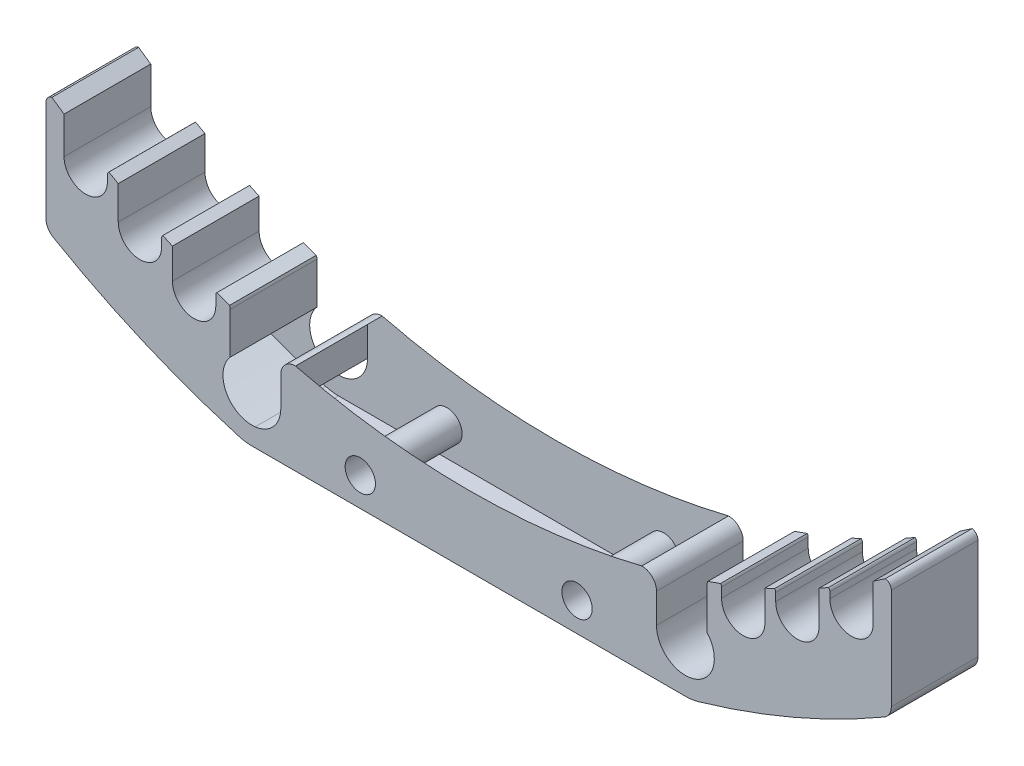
SolidWorks part; units mm, degrees
ref_plane "Front Plane" through (0, 0, 0) normal (0, 0, 1) x (1, 0, 0)
ref_plane "Top Plane" through (0, 0, 0) normal (0, 1, 0) x (1, 0, 0)
ref_plane "Right Plane" through (0, 0, 0) normal (1, 0, 0) x (0, 0, -1)
surface "Surface-Knit1"
surface "Surface-Fill1"
surface "Surface-Fill2"
surface "Surface-Fill3"
surface "Surface-Fill4"
surface "Surface-Fill5"
surface "Surface-Fill6"
surface "Surface-Fill7"
surface "Surface-Fill8"
surface "Surface-Fill10"
surface "Surface-Fill11"
sketch "Sketch1" plane through (0, 0, -27265.7996) normal (0, 0, -1) x (-1, 0, 0)
  line L0 (7768.5295, -23923.5155) -> (7768.5296, -23923.5655)
  line L1 (7768.5296, -23923.5655) -> (7768.4293, -23923.5655)
  line L2 (7768.4293, -23923.5655) -> (7768.4293, -23923.5155)
  line L3 (7768.4293, -23923.5155) -> (7768.5295, -23923.5155)
surface "Surface-Trim2"
surface "Surface-Fill15"
sketch "Sketch4" plane through (0, 0, 31.368) normal (0, 0, -1) x (-1, 0, 0)
  line L0 (-42.3326, -90.9297) -> (-42.3326, -106.1288)
  arc A0 (-57.5066, -98.7339) -> (-31.8096, -109.743) centre (0, 0) ccw construction
extrude "Cut-Extrude3" cut sketch "Sketch4" against normal through all both and the other way through all flip side to cut
sketch "Sketch5" plane through (0, 0, 31.368) normal (0, 0, -1) x (-1, 0, 0)
  line L0 (42.3326, -90.9297) -> (42.3326, -106.1288)
  arc A0 (31.8096, -109.743) -> (57.5066, -98.7339) centre (0, 0) ccw construction
extrude "Cut-Extrude4" cut sketch "Sketch5" against normal through all both and the other way through all
